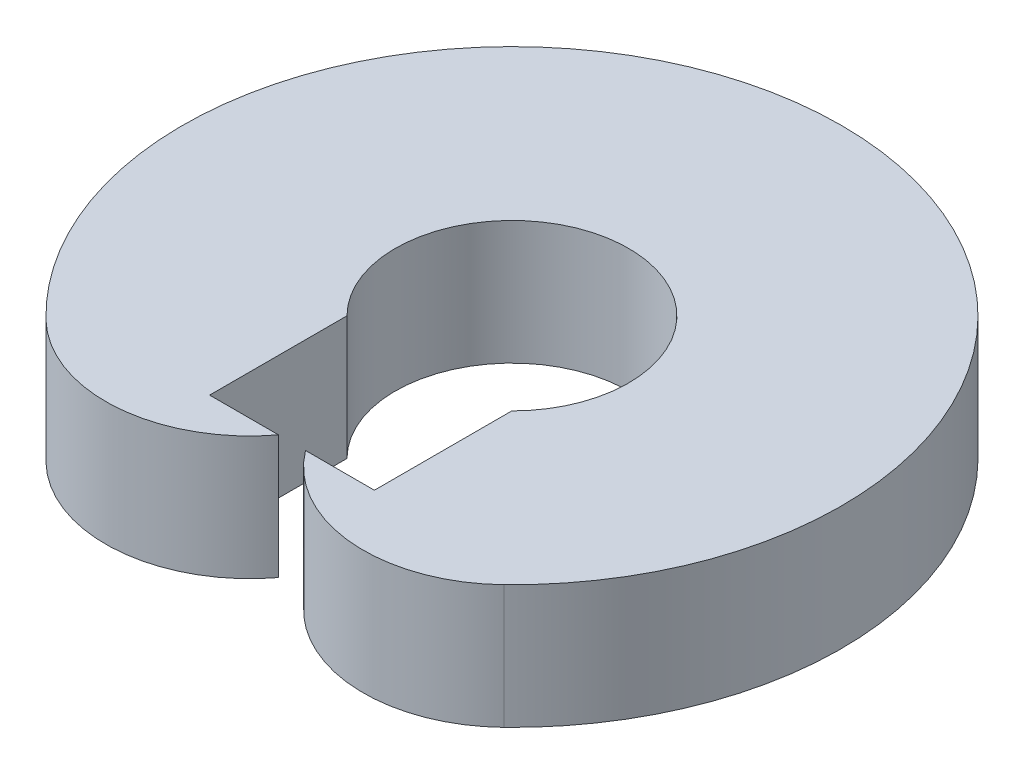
SolidWorks part; units mm, degrees
ref_plane "前视基准面" through (0, 0, 0) normal (0, 0, 1) x (1, 0, 0)
ref_plane "上视基准面" through (0, 0, 0) normal (0, 1, 0) x (1, 0, 0)
ref_plane "右视基准面" through (0, 0, 0) normal (1, 0, 0) x (0, 0, -1)
sketch "草图1" plane through (0, 0, 0) normal (0, 1, 0) x (1, 0, 0)
  line L0 (0, 0) -> (0, 400) construction
  line L1 (0, 0) -> (400, 0) construction
  line L2 (0, 0) -> (-277.8633, -287.7359) construction
  line L3 (0, 0) -> (277.8633, -287.7359) construction
  line L4 (0, 225) -> (-110.1311, 88.9995) construction
  line L5 (-100, -100.2485) -> (-100, -267)
  line L6 (100, -100.2485) -> (100, -267)
  line L7 (-100, -267) -> (-16.4097, -267)
  line L8 (16.4097, -267) -> (100, -267)
  arc A0 (277.8633, -287.7359) -> (-277.8633, -287.7359) centre (0, 0) ccw
  arc A1 (-277.8633, -287.7359) -> (-16.4097, -267) centre (-156.2981, -161.8515) ccw
  arc A2 (98.3617, -101.8565) -> (-98.3617, -101.8565) centre (0, 0) ccw
  arc A3 (277.8633, -287.7359) -> (16.4097, -267) centre (156.2981, -161.8515) cw
  dimension "D1" = 800
  dimension "D4" = 350
  dimension "D2" = 136
  dimension "D3" = 136
  dimension "D5" = 225
  dimension "D6" = 225
  dimension "D7" = 141
  dimension "D8" = 175
  dimension "D9" = 100
  dimension "D10" = 267
  dimension "D11" = 100
extrude "凸台-拉伸1" add sketch "草图1" along normal blind 150 contours A3 A0 A1 L7 L5 A2 L6 L8
